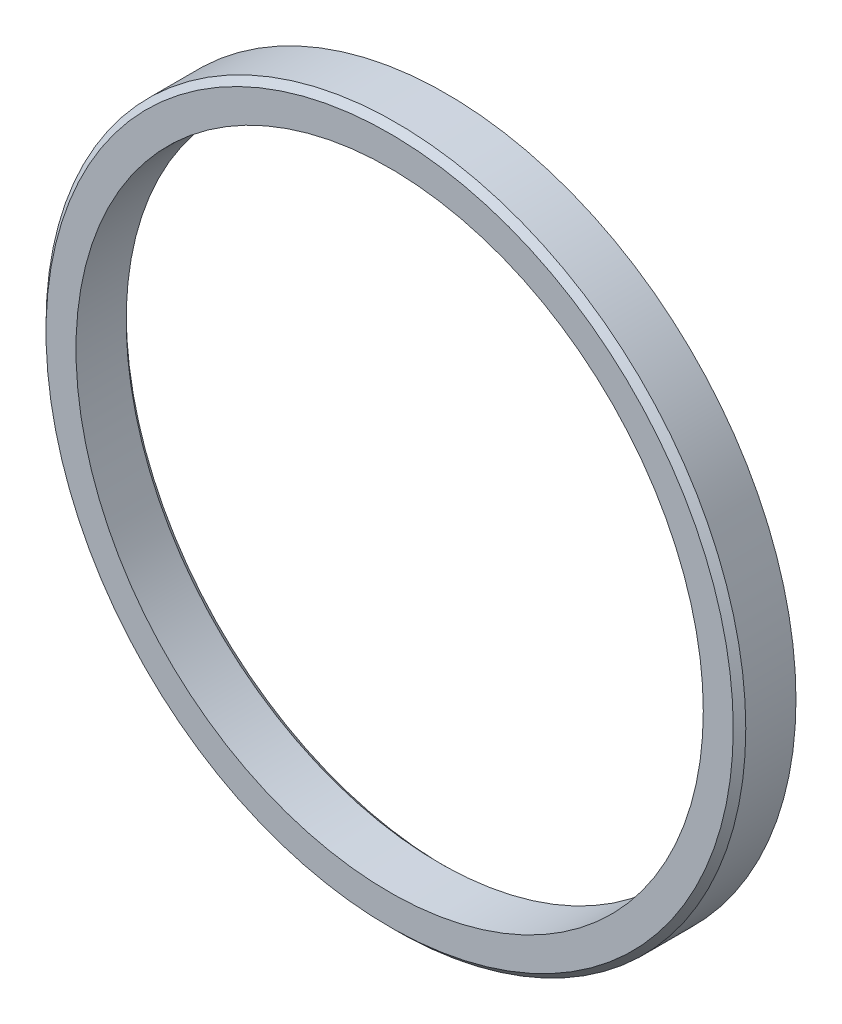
SolidWorks part; units mm, degrees
ref_plane "Front Plane" through (0, 0, 0) normal (0, 0, 1) x (1, 0, 0)
ref_plane "Top Plane" through (0, 0, 0) normal (0, 1, 0) x (1, 0, 0)
ref_plane "Right Plane" through (0, 0, 0) normal (1, 0, 0) x (0, 0, -1)
sketch "Sketch1" plane through (0, 0, 0) normal (1, 0, 0) x (0, 0, -1)
  line L0 (-66.6227, 0) -> (66.6227, 0) construction
  line L1 (-8, 100) -> (8, 100)
  line L2 (8, 100) -> (10, 102)
  line L3 (10, 102) -> (10, 111.55)
  line L4 (10, 111.55) -> (-6, 111.55)
  line L5 (-6, 111.55) -> (-8, 109.55)
  line L6 (-8, 109.55) -> (-8, 100)
  line L7 (0, -152.3213) -> (0, 152.3213) construction
  point P3 (0, 100)
  point P4 (0, 0)
  point P13 (0, 0)
  dimension "D1" = 45
  dimension "D2" = 45
  dimension "D3" = 2
  dimension "D4" = 2
  dimension "D5" = 200
  dimension "D6" = 223.1
  dimension "D7" = 18
revolve "Revolve1" add sketch "Sketch1" angle 360 about L0
